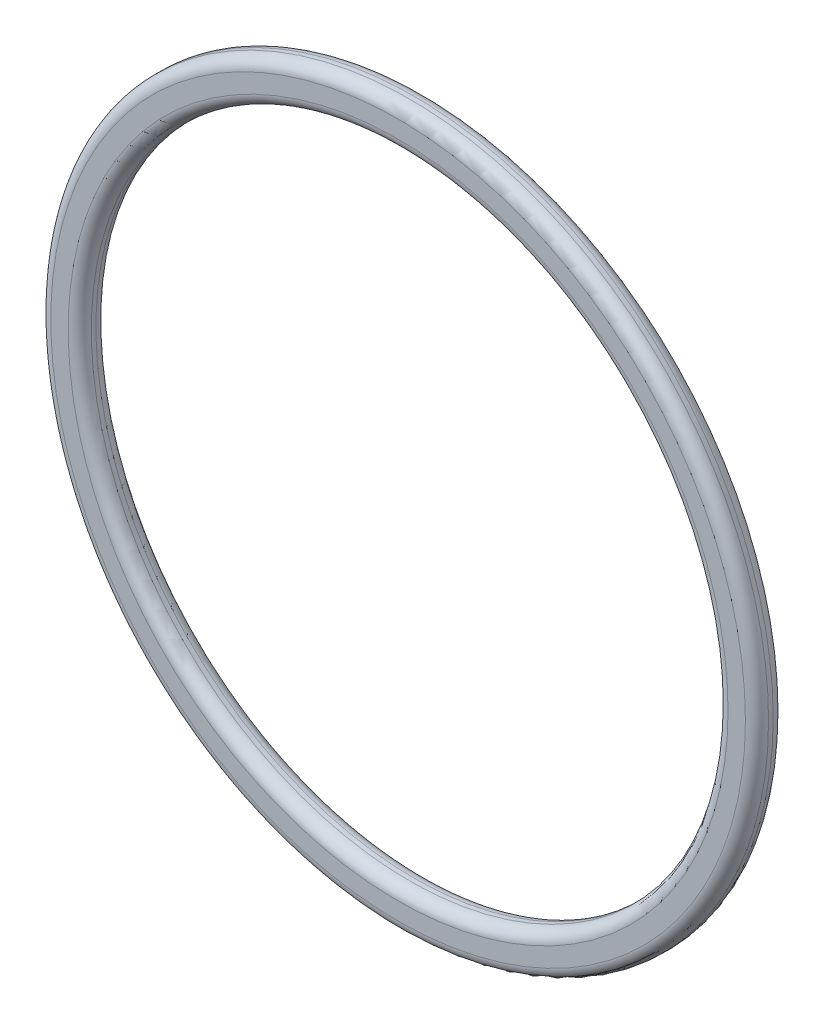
SolidWorks part; units mm, degrees
ref_plane "Plan de face" through (0, 0, 0) normal (0, 0, 1) x (1, 0, 0)
ref_plane "Plan de dessus" through (0, 0, 0) normal (0, 1, 0) x (1, 0, 0)
ref_plane "Plan de droite" through (0, 0, 0) normal (1, 0, 0) x (0, 0, -1)
sketch "Esquisse1" plane through (0, 0, 0) normal (1, 0, 0) x (0, 0, -1)
  line L0 (-20.8244, 0) -> (21.7431, 0) construction
  line L2 (1.4594, 31) -> (1.8594, 31)
  line L3 (0.4594, 30) -> (0.4594, 28.5)
  line L4 (1.4594, 27.5) -> (1.8594, 27.5)
  line L5 (2.8594, 30) -> (2.8594, 28.5)
  arc A0 (1.8594, 27.5) -> (2.8594, 28.5) centre (1.8594, 28.5) ccw
  arc A1 (1.8594, 31) -> (2.8594, 30) centre (1.8594, 30) cw
  arc A2 (1.4594, 31) -> (0.4594, 30) centre (1.4594, 30) ccw
  arc A3 (0.4594, 28.5) -> (1.4594, 27.5) centre (1.4594, 28.5) ccw
  dimension "D4" = 1
  dimension "D1" = 55
  dimension "D2" = 62
  dimension "D3" = 2.4
revolve "Révolution1" add sketch "Esquisse1" angle 360 about L0
